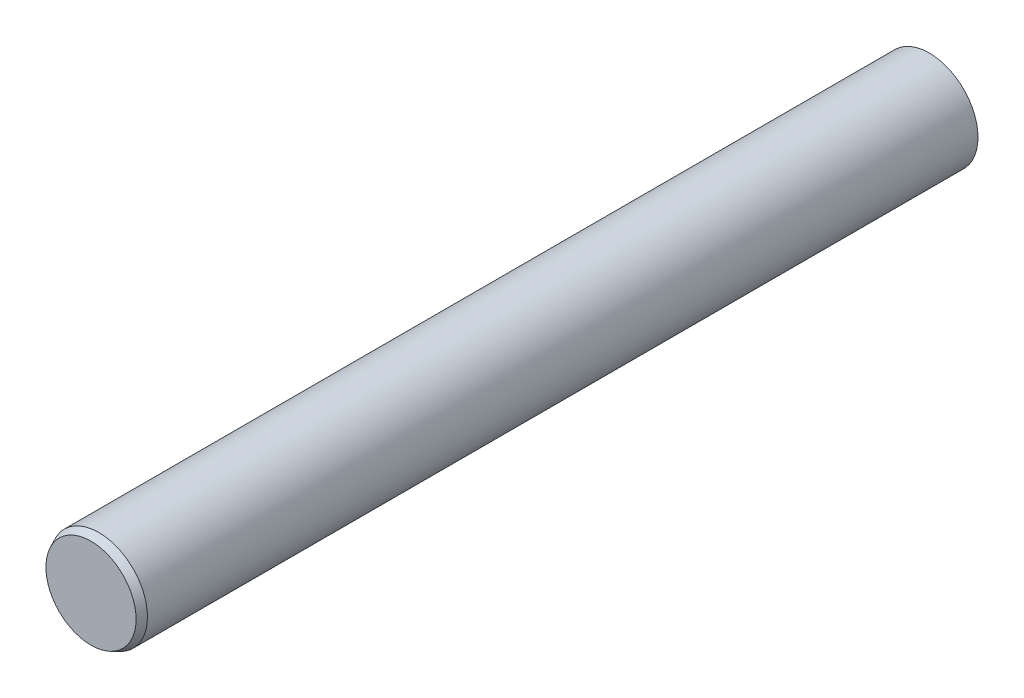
SolidWorks part; units mm, degrees
ref_plane "Front Plane" through (0, 0, 0) normal (0, 0, 1) x (1, 0, 0)
ref_plane "Top Plane" through (0, 0, 0) normal (0, 1, 0) x (1, 0, 0)
ref_plane "Right Plane" through (0, 0, 0) normal (1, 0, 0) x (0, 0, -1)
sketch "Sketch1" plane through (0, 0, 0) normal (0, 0, 1) x (1, 0, 0)
  circle A0 centre (0, 0) radius 2.3876
  dimension "D1" = 4.7752
extrude "Boss-Extrude1" add sketch "Sketch1" along normal mid plane 41.275
chamfer "Chamfer1" distance 0.381 angle 25 2 edges at (2.3876, 0, -20.6375) (2.3876, 0, 20.6375)
